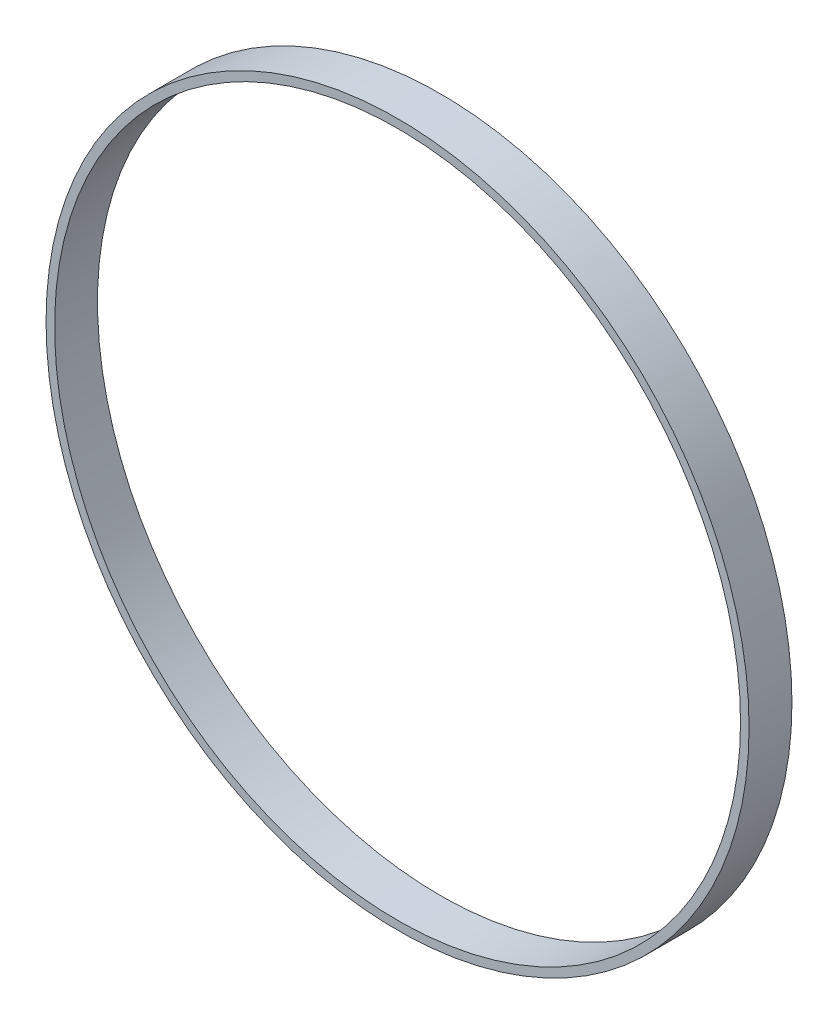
SolidWorks part; units mm, degrees
ref_plane "Plan de face" through (0, 0, 0) normal (0, 0, 1) x (1, 0, 0)
ref_plane "Plan de dessus" through (0, 0, 0) normal (0, 1, 0) x (1, 0, 0)
ref_plane "Plan de droite" through (0, 0, 0) normal (1, 0, 0) x (0, 0, -1)
sketch "Esquisse1" plane through (0, 0, 0) normal (0, 0, 1) x (1, 0, 0)
  circle A0 centre (0, 0) radius 40
  circle A1 centre (0, 0) radius 41
  dimension "D1" = 80
  dimension "D2" = 82
extrude "Extrusion1" add sketch "Esquisse1" along normal blind 5
